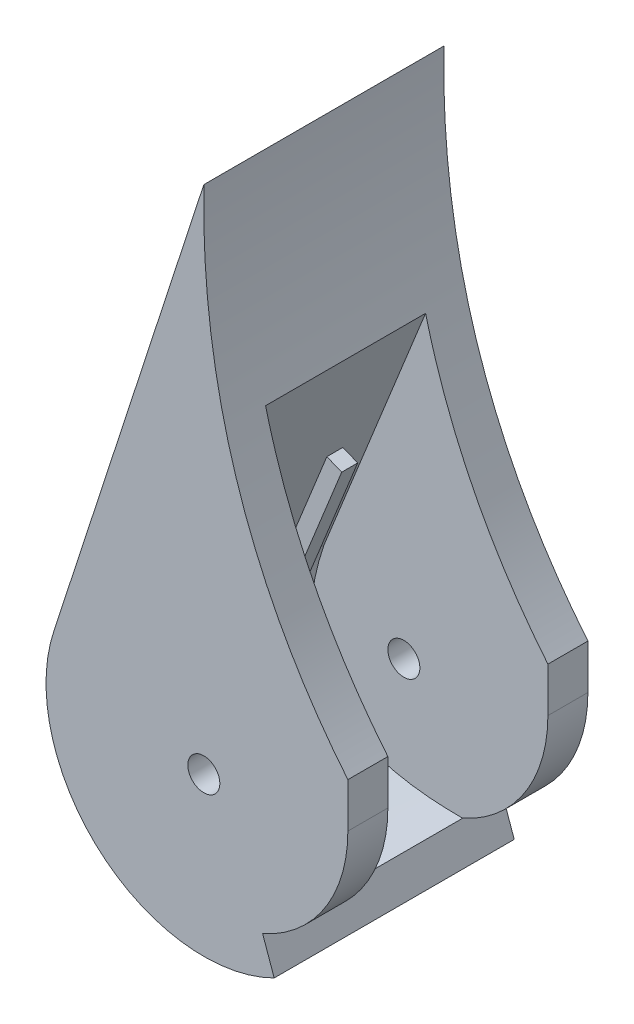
SolidWorks part; units mm, degrees
ref_plane "Front Plane" through (0, 0, 0) normal (0, 0, 1) x (1, 0, 0)
ref_plane "Top Plane" through (0, 0, 0) normal (0, 1, 0) x (1, 0, 0)
ref_plane "Right Plane" through (0, 0, 0) normal (1, 0, 0) x (0, 0, -1)
sketch "Sketch1" plane through (0, 0, 0) normal (0, 0, 1) x (1, 0, 0)
  line L5 (-18.975, 44.9666) -> (-18.975, -30.4912) construction
  line L7 (-9.975, -11.1037) -> (-9.975, -0.1037)
  line L8 (-18.975, 27.5984) -> (-28.3349, -1.2115)
  line L11 (-15.3008, -11.1037) -> (-9.975, -11.1037)
  line L12 (-15.3008, -11.1037) -> (-14.5785, -13.1398)
  circle A0 centre (-18.975, -4.3136) radius 1
  arc A1 (-28.3349, -1.2115) -> (-14.5785, -13.1398) centre (-18.975, -4.3136) ccw
  circle A2 centre (-18.975, -4.3136) radius 9.8606 construction
  spline S0 degree 2 poles (-9.975, -0.1037) (-19.2872, 11.2608) (-18.975, 27.5984) knots 0 0 0 1 1 1
  dimension "D2" = 2
  dimension "D3" = 31.9121
  dimension "D9" = 4.3136
  dimension "D10" = 29.7699
  dimension "D8" = 9.8606
  dimension "D1" = 18.975
  dimension "D4" = 17.998
  dimension "D5" = 4.21
  dimension "D6" = 9
  dimension "D7" = 11
extrude "Boss-Extrude1" add sketch "Sketch1" along normal mid plane 15
sketch "Sketch3" plane through (0, 0, 0) normal (0, 0, 1) x (1, 0, 0)
  line L0 (-8.7386, 37.0392) -> (-23.9708, -0.6618)
  line L2 (3.1267, -8.7234) -> (3.1267, 11.2092)
  line L3 (3.1267, 11.2092) -> (-8.7386, 37.0392)
  line L4 (-1.0416, 40.0732) -> (-30.7503, -33.4584) construction
  line L8 (-7.1269, -14.6801) -> (3.1267, -8.7234)
  line L10 (-15.3008, -11.1037) -> (-7.1269, -14.6801)
  line L11 (45.5554, 0) -> (-52.8158, 0) construction
  spline S0 degree 2 poles (-23.9708, -0.6618) (-27.5008, -11.1544) (-15.3008, -11.1037) knots 0 0 0 1 1 1
  dimension "D3" = 17.1539
  dimension "D1" = 6
  dimension "D2" = 68
extrude "Cut-Extrude2" cut sketch "Sketch3" against normal mid plane 10
fillet "Fillet4" radius 9 2 edges at (-9.975, -11.1037, -6.25) (-9.975, -11.1037, 6.25)
sketch "Sketch4" plane through (-20.3771, 8.2329, 0) normal (0.9272, -0.3746, 0) x (0, 0, -1)
  line L1 (-3, -9.0932) -> (3, -9.0932)
  line L2 (-3, -9.0932) -> (-3, -1.0932)
  line L3 (-3, -1.0932) -> (3, -1.0932)
  line L4 (3, -9.0932) -> (3, -1.0932)
  line L5 (5, -9.5932) -> (-5, -9.5932) construction
  line L6 (0, 10.3733) -> (0, -10.3733) construction
  line L7 (-3, -1.0932) -> (-2, -1.0932)
  line L8 (-3, -1.0932) -> (-3, -9.0932)
  line L9 (-3, -9.0932) -> (-2, -9.0932)
  line L10 (-2, -1.0932) -> (-2, -9.0932)
  line L11 (3, -9.0932) -> (2, -9.0932)
  line L12 (2, -1.0932) -> (2, -9.0932)
  line L13 (3, -1.0932) -> (2, -1.0932)
  line L14 (3, -1.0932) -> (3, -9.0932)
  point P6 (0, -1.0932)
  dimension "D1" = 4
  dimension "D2" = 8
  dimension "D3" = 0.5
  dimension "D4" = 1
extrude "Boss-Extrude4" add sketch "Sketch4" along normal blind 1 contours L10 L3 L2 L1 | L3 L12 L1 L4
